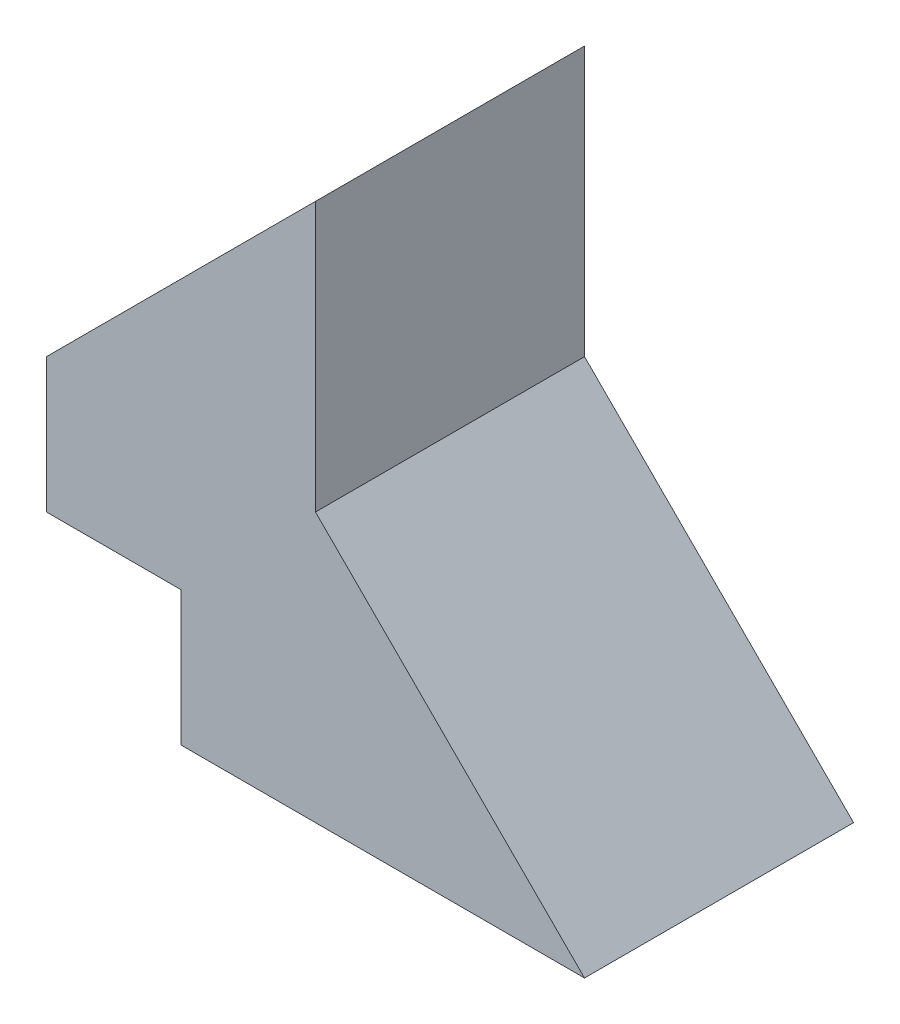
SolidWorks part; units mm, degrees
ref_plane "Plan de face" through (0, 0, 0) normal (0, 0, 1) x (1, 0, 0)
ref_plane "Plan de dessus" through (0, 0, 0) normal (0, 1, 0) x (1, 0, 0)
ref_plane "Plan de droite" through (0, 0, 0) normal (1, 0, 0) x (0, 0, -1)
sketch "Esquisse1" plane through (0, 0, 0) normal (0, 0, 1) x (1, 0, 0)
  line L0 (0, 5) -> (0, 20)
  line L1 (0, 20) -> (10, 20)
  line L2 (10, 20) -> (10, 10)
  line L3 (10, 10) -> (20, 10)
  line L4 (20, 10) -> (20, 0)
  line L5 (20, 0) -> (5, 0)
  line L8 (0, 0) -> (0, 5)
  line L9 (0, 5) -> (5, 5)
  line L10 (5, 0) -> (5, 5)
  dimension "D1" = 10
  dimension "D2" = 10
  dimension "D3" = 20
  dimension "D4" = 20
  dimension "D5" = 5
  dimension "D6" = 5
  dimension "D7" = 15
extrude "Boss.-Extru.1" add sketch "Esquisse1" along normal blind 10 contours L10 L5 L4 L3 L2 L1 L0 L9
chamfer "Chanfrein1" distance 10 angle 45 1 edges at (0, 20, 5)
chamfer "Chanfrein2" distance 10 angle 45 1 edges at (20, 10, 5)
